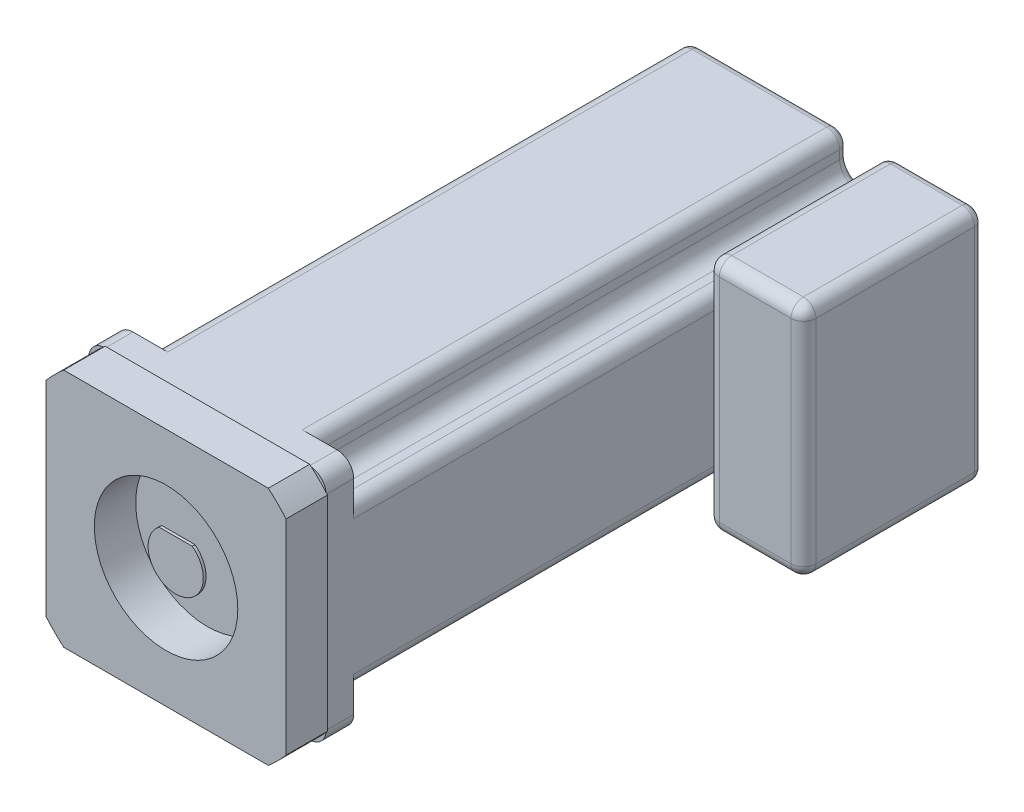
SolidWorks part; units mm, degrees
ref_plane "Front Plane" through (0, 0, 0) normal (0, 0, 1) x (1, 0, 0)
ref_plane "Top Plane" through (0, 0, 0) normal (0, 1, 0) x (1, 0, 0)
ref_plane "Right Plane" through (0, 0, 0) normal (1, 0, 0) x (0, 0, -1)
sketch "Sketch1" plane through (0, 0, 0) normal (0, 0, 1) x (1, 0, 0)
  line L0 (-6, 8) -> (6, 8)
  line L1 (0, 8) -> (0, 0) construction
  line L2 (0, 0) -> (-10, 0) construction
  line L3 (0, 0) -> (-7.0711, 7.0711) construction
  arc A0 (-6, 8) -> (6, 8) centre (0, 0) ccw
  dimension "D4" = 10
  dimension "D1" = 45
  dimension "D2" = 45
  dimension "D3" = 8
extrude "Boss-Extrude1" add sketch "Sketch1" along normal blind 1
sketch "Sketch2" plane through (0, 0, 0) normal (0, 0, 1) x (1, 0, 0)
  line L1 (-37.0658, 43.5) -> (37.0658, 43.5)
  line L2 (-43.5, 37.0658) -> (-43.5, -37.0658)
  line L3 (-37.0658, -43.5) -> (37.0658, -43.5)
  line L4 (43.5, 37.0658) -> (43.5, -37.0658)
  line L5 (0, -43.5) -> (0, 43.5) construction
  line L6 (-43.5, 0) -> (43.5, 0) construction
  arc A0 (-37.0658, 43.5) -> (-43.5, 37.0658) centre (0, 0) ccw
  arc A1 (43.5, 37.0658) -> (37.0658, 43.5) centre (0, 0) ccw
  arc A2 (37.0658, -43.5) -> (43.5, -37.0658) centre (0, 0) ccw
  arc A3 (-43.5, -37.0658) -> (-37.0658, -43.5) centre (0, 0) ccw
  circle A4 centre (0, 0) radius 26
  point P0 (0, 0)
  dimension "D2" = 114.3
  dimension "D3" = 52
  dimension "D1" = 87
extrude "Boss-Extrude2" add sketch "Sketch2" against normal blind 15 from offset 4.5 separate body
sketch "Sketch3" plane through (0, 0, -10.5) normal (0, 0, -1) x (-1, 0, 0)
  line L1 (43, 43) -> (-43, 43)
  line L2 (43, 43) -> (43, -43)
  line L3 (43, -43) -> (-43, -43)
  line L4 (-43, 43) -> (-43, -43)
  line L5 (0, -43) -> (0, 43) construction
  line L6 (43, 0) -> (-43, 0) construction
  point P0 (0, 0)
  dimension "D1" = 86
extrude "Boss-Extrude3" add sketch "Sketch3" along normal blind 203 separate body
sketch "Sketch4" plane through (0, 0, -213.5) normal (0, 0, -1) x (-1, 0, 0)
  line L1 (-43, 43) -> (-29.1, 43)
  line L2 (-43, 43) -> (-43, 29.1)
  line L3 (-43, 29.1) -> (-29.1, 29.1)
  line L4 (-29.1, 43) -> (-29.1, 29.1)
  line L5 (43, 43) -> (29.1, 43)
  line L6 (43, 43) -> (43, 29.1)
  line L7 (43, 29.1) -> (29.1, 29.1)
  line L8 (29.1, 43) -> (29.1, 29.1)
  line L9 (43, -43) -> (29.1, -43)
  line L10 (43, -43) -> (43, -29.1)
  line L11 (43, -29.1) -> (29.1, -29.1)
  line L12 (29.1, -43) -> (29.1, -29.1)
  line L13 (-43, -43) -> (-29.1, -43)
  line L14 (-43, -43) -> (-43, -29.1)
  line L15 (-43, -29.1) -> (-29.1, -29.1)
  line L16 (-29.1, -43) -> (-29.1, -29.1)
  circle A0 centre (0, 0) radius 41.1536 construction
  dimension "D1" = 13.9
extrude "Cut-Extrude1" cut sketch "Sketch4" against normal offset from surface (193 mm away) 10
fillet "Fillet1" radius 6 8 edges at (-43, -43, -15.5) (43, -43, -15.5) (-43, 43, -15.5) (43, 43, -15.5) (-29.1, 29.1, -117) (-29.1, -29.1, -117) (29.1, -29.1, -117) (29.1, 29.1, -117)
fillet "Fillet2" radius 4.7 8 edges at (29.1, -43, -117) (43, -29.1, -117) (43, 29.1, -117) (29.1, 43, -117) (-29.1, 43, -117) (-43, 29.1, -117) (-43, -29.1, -117) (-29.1, -43, -117)
fillet "Fillet3" radius 3 24 edges at (41.6234, 27.7234, -213.5) (36.7, 29.1, -213.5) (30.8574, 30.8574, -213.5) (29.1, 36.7, -213.5) (27.7234, 41.6234, -213.5) (0, 43, -213.5) (-27.7234, 41.6234, -213.5) (-29.1, 36.7, -213.5) (-30.8574, 30.8574, -213.5) (-36.7, 29.1, -213.5) (-41.6234, 27.7234, -213.5) (-43, 0, -213.5) (-41.6234, -27.7234, -213.5) (-36.7, -29.1, -213.5) (-30.8574, -30.8574, -213.5) (-29.1, -36.7, -213.5) (-27.7234, -41.6234, -213.5) (0, -43, -213.5) (27.7234, -41.6234, -213.5) (29.1, -36.7, -213.5) (30.8574, -30.8574, -213.5) (36.7, -29.1, -213.5) (41.6234, -27.7234, -213.5) (43, 0, -213.5)
sketch "Sketch5" plane through (43, 0, 0) normal (1, 0, 0) x (0, 0, -1)
  line L0 (213.5, 24.4) -> (213.5, -24.4) construction
  line L1 (213.5, 43) -> (148.5, 43)
  line L2 (213.5, 43) -> (213.5, -43)
  line L3 (213.5, -43) -> (148.5, -43)
  line L4 (148.5, 43) -> (148.5, -43)
  line L5 (181, -43) -> (181, 43) construction
  line L6 (213.5, 0) -> (148.5, 0) construction
  line L8 (10.5, -37.0658) -> (10.5, 37.0658) construction
  point P0 (181, 0)
  dimension "D1" = 138
  dimension "D2" = 86
extrude "Boss-Extrude4" add sketch "Sketch5" along normal blind 35
fillet "Fillet5" radius 4.5 8 edges at (78, 43, -181) (60.5, 43, -148.5) (43, 43, -181) (43, 0, -148.5) (43, -43, -181) (60.5, -43, -148.5) (78, 0, -148.5) (78, -43, -181)
fillet "Fillet7" radius 3 8 edges at (76.682, -41.682, -213.5) (60.5, -43, -213.5) (44.318, -41.682, -213.5) (43, 0, -213.5) (44.318, 41.682, -213.5) (60.5, 43, -213.5) (76.682, 41.682, -213.5) (78, 0, -213.5)
